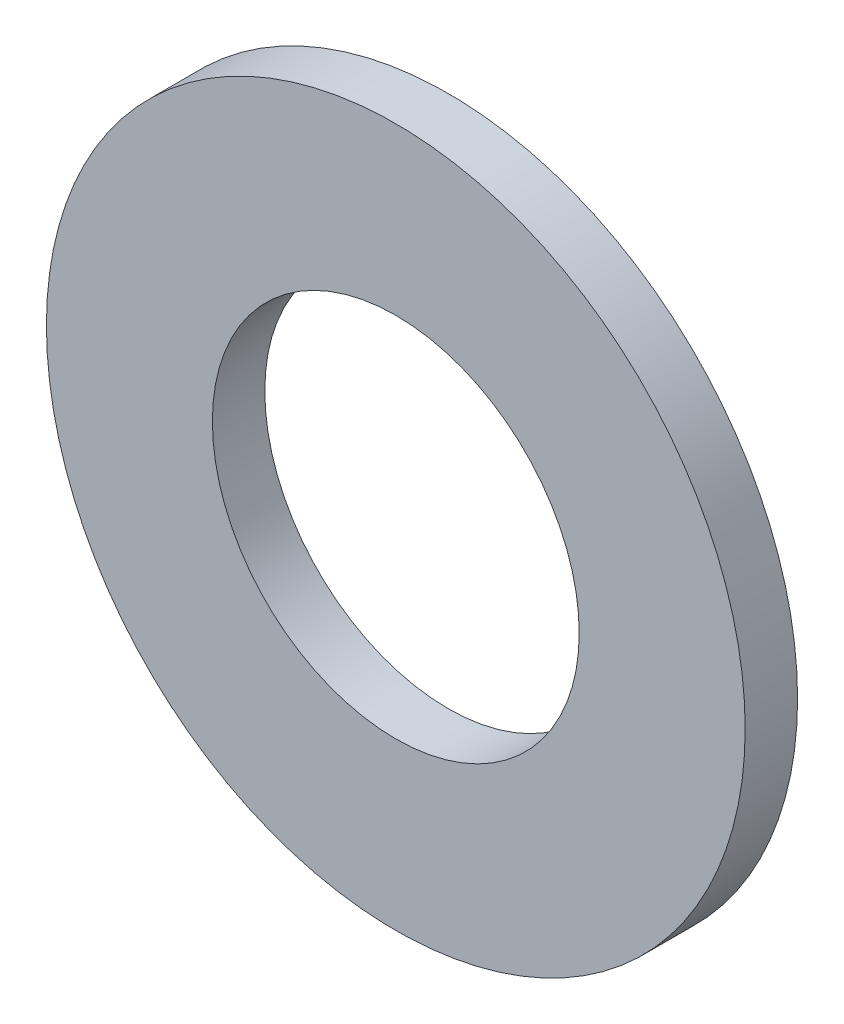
SolidWorks part; units mm, degrees
ref_plane "Plan1" through (0, 0, 0) normal (0, 0, 1) x (1, 0, 0)
ref_plane "Plan2" through (0, 0, 0) normal (0, 1, 0) x (1, 0, 0)
ref_plane "Plan3" through (0, 0, 0) normal (1, 0, 0) x (0, 0, -1)
extrude "Corps" add sketch "E_corps" along normal blind 3
sketch "E_corps" plane through (0, 0, 0) normal (0, 0, 1) x (1, 0, 0)
  circle A0 centre (0, 0) radius 20
  dimension "Diam_base" = 40
extrude "Diamètre_nominal" cut sketch "E_perçage" against normal through all
sketch "E_perçage" plane through (0, 0, 0) normal (0, 0, -1) x (-1, 0, 0)
  circle A0 centre (0, 0) radius 10.5
  dimension "Diamètre_nominal" = 21
